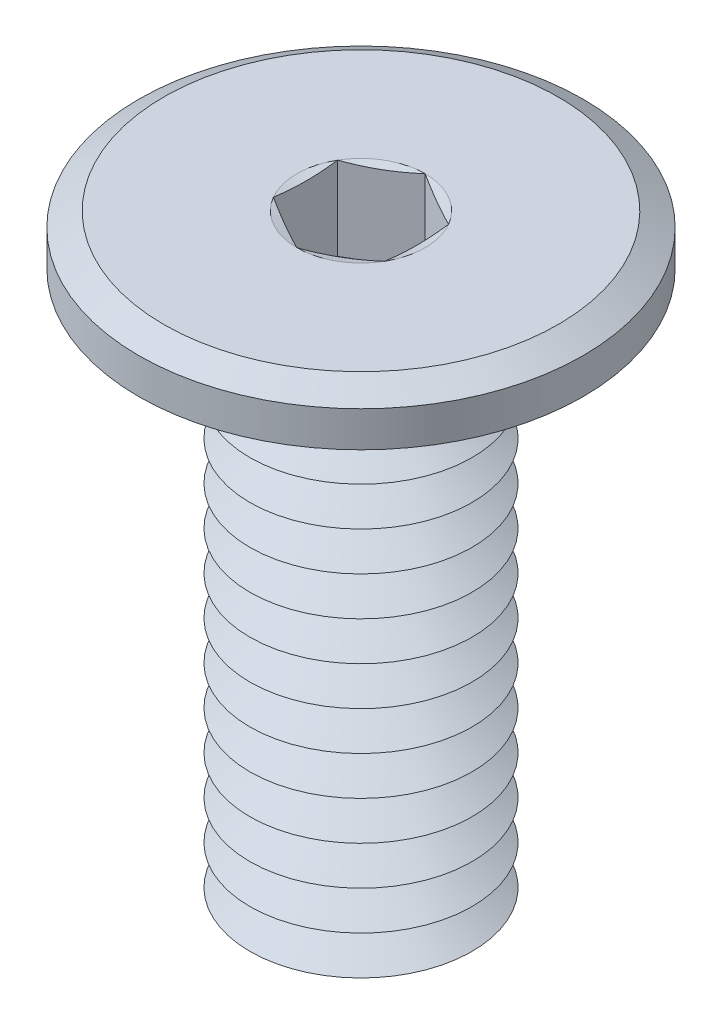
SolidWorks part; units mm, degrees
ref_plane "Front Plane" through (0, 0, 0) normal (0, 0, 1) x (1, 0, 0)
ref_plane "Top Plane" through (0, 0, 0) normal (0, 1, 0) x (1, 0, 0)
ref_plane "Right Plane" through (0, 0, 0) normal (1, 0, 0) x (0, 0, -1)
sketch "Sketch1" plane through (0, 0, 0) normal (0, 1, 0) x (1, 0, 0)
  circle A0 centre (0, 0) radius 4
  dimension "D1" = 8
extrude "Boss-Extrude1" add sketch "Sketch1" against normal blind 0.9
sketch "Sketch2" plane through (0, -0.9, 0) normal (0, -1, 0) x (1, 0, 0)
  circle A0 centre (0, 0) radius 2
  dimension "D1" = 4
extrude "Boss-Extrude2" add sketch "Sketch2" along normal blind 10
sketch "Sketch3" plane through (0, 0, 0) normal (1, 0, 0) x (0, 0, -1)
  line L0 (0, 0.9906) -> (0, -8.2999) construction
sketch "Sketch5" plane through (0, 0, 0) normal (1, 0, 0) x (0, 0, -1)
  line L0 (-2, -11.25) -> (-1.3938, -10.9)
  line L1 (-2, -0.9) -> (-2, -10.9) construction
  line L2 (-1.3938, -10.9) -> (-2, -10.55)
  line L3 (-2, -0.9) -> (-2, -10.9) construction
  line L4 (-2, -10.55) -> (-2, -11.25)
  line L6 (-2, -0.9) -> (-2, -10.9) construction
  line L7 (-2, -0.9) -> (-2, -10.9) construction
  line L14 (-2, -10.9) -> (2, -10.9) construction
  dimension "D1" = 0.7
revolve "Cut-Revolve1" cut sketch "Sketch5" angle 360 about L0
pattern_linear "LPattern1" count 13 spacing 0.7 along (0, 1, 0) of "Cut-Revolve1"
fillet "Fillet1" radius 0.2 1 edges at (0, -0.9, -2)
chamfer "Chamfer2" distance 0.45 angle 30 1 edges at (0, 0, 4)
sketch "Sketch6" plane through (0, 0, 0) normal (0, 1, 0) x (1, 0, 0)
  line L1 (0, 1.1547) -> (-1, 0.5774)
  line L2 (-1, 0.5774) -> (-1, -0.5774)
  line L3 (-1, -0.5774) -> (0, -1.1547)
  line L4 (0, -1.1547) -> (1, -0.5774)
  line L5 (1, -0.5774) -> (1, 0.5774)
  line L6 (1, 0.5774) -> (0, 1.1547)
  circle A0 centre (0, 0) radius 1 construction
  dimension "D1" = 2
extrude "Cut-Extrude1" cut sketch "Sketch6" against normal blind 1.5
sketch "Sketch7" plane through (0, -1.5, 0) normal (0, 1, 0) x (1, 0, 0)
  line L0 (-1, 0.5774) -> (-1, -0.5774) construction
  circle A0 centre (0, 0) radius 1
extrude "Cut-Extrude2" cut sketch "Sketch7" against normal through all draft 60
sketch "Sketch8" plane through (0, 0, 0) normal (0, 1, 0) x (1, 0, 0)
  circle A0 centre (0, 0) radius 1.1547
extrude "Cut-Extrude3" cut sketch "Sketch8" against normal through all draft 75
